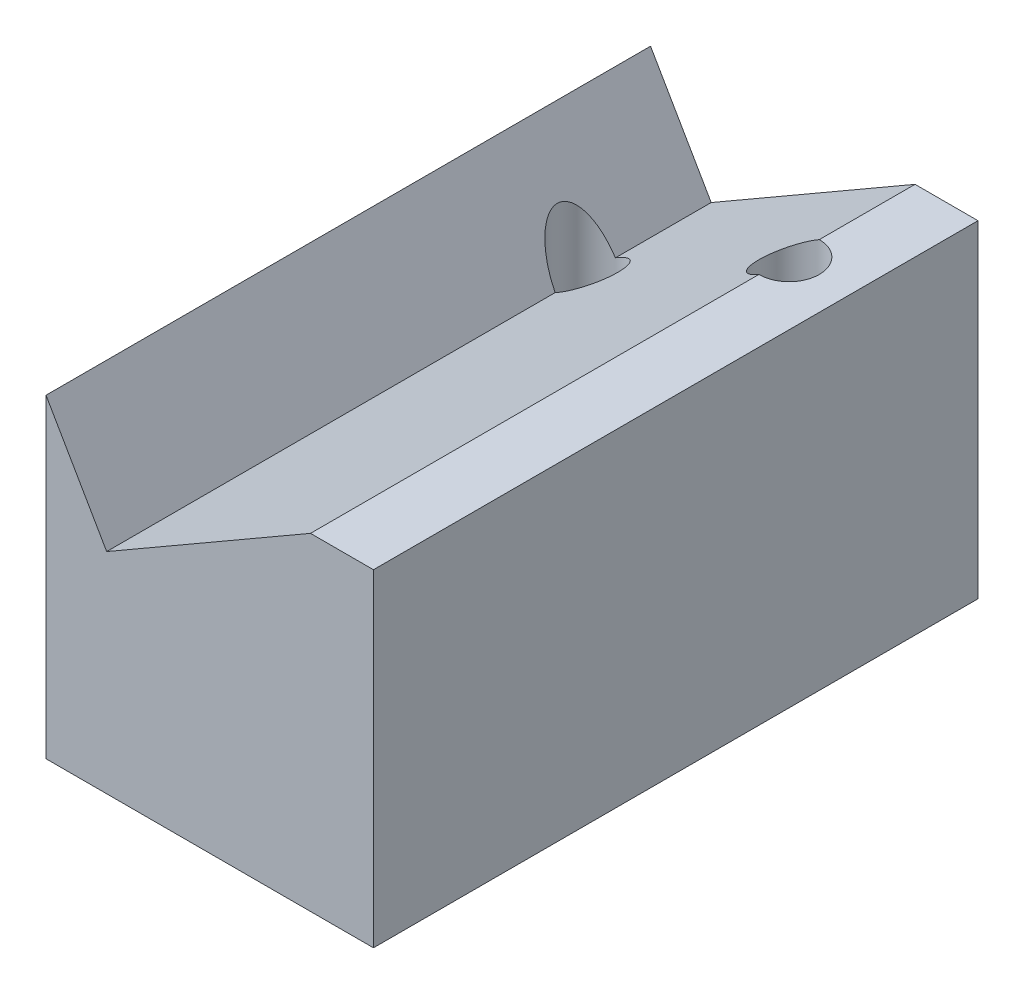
SolidWorks part; units mm, degrees
ref_plane "Face" through (0, 0, 0) normal (0, 0, 1) x (1, 0, 0)
ref_plane "Dessus" through (0, 0, 0) normal (0, 1, 0) x (1, 0, 0)
ref_plane "Droite" through (0, 0, 0) normal (1, 0, 0) x (0, 0, -1)
sketch "Esquisse1" plane through (0, 0, 0) normal (0, 0, 1) x (1, 0, 0)
  line L0 (6.5, 13) -> (4, 13)
  line L1 (-6.5, 0) -> (6.5, 0)
  line L2 (-6.5, 0) -> (-6.5, 12.5)
  line L4 (6.5, 0) -> (6.5, 13)
  line L5 (4, 13) -> (-4.0915, 8.3284)
  line L6 (-4.0915, 8.3284) -> (-6.5, 12.5)
  dimension "D1" = 2.5
  dimension "D2" = 13
  dimension "D3" = 13
  dimension "D4" = 12.5
  dimension "D5" = 30
  dimension "D6" = 6.5
extrude "Extrusion1" add sketch "Esquisse1" along normal blind 24
hole_wizard "Trou taraudé M3x0.51" positions "Esquisse3" profile "Esquisse2" tap size "M3x0.5" standard "ISO"
sketch "Esquisse3" plane through (0, 0, 0) normal (0, -1, 0) x (1, 0, 0)
  line L0 (-17.0779, 5) -> (9.3151, 5) construction
  line L1 (-25.5, 0) -> (6.5, 0) construction
  point P0 (-4, 5)
  point P1 (4, 5)
  dimension "D1" = 5
  dimension "D2" = 8
  dimension "D3" = 4
sketch "Esquisse2" plane through (-4, 0, 5) normal (1, 0, 0) x (0, 0, -1)
  line L0 (0, 0) -> (0, 13)
  line L1 (0, 13) -> (1.2, 13)
  line L2 (1.2, 13) -> (1.2, 0)
  line L5 (1.2, 0) -> (0, 0)
  line L11 (0, -6.35) -> (0, 107.95) construction
  dimension "Diamètre du trou pour taraudage jusqu'au prochain" = 2.4
  dimension "Profondeur du trou pour taraudage jusqu'au prochain" = 13
